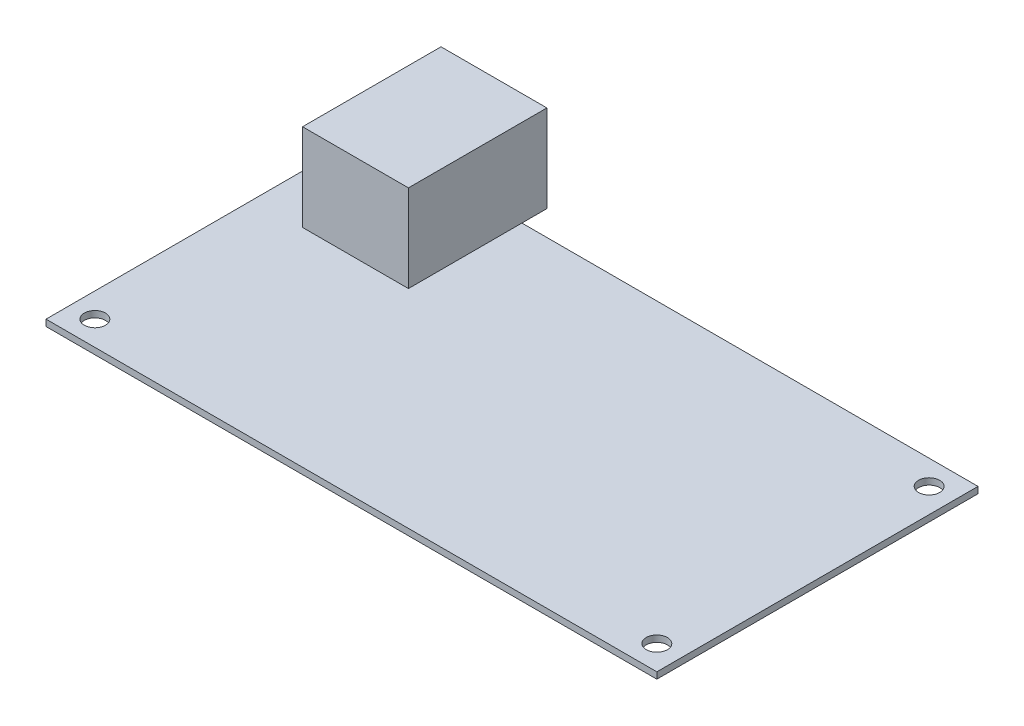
SolidWorks part; units mm, degrees
ref_plane "Front Plane" through (0, 0, 0) normal (0, 0, 1) x (1, 0, 0)
ref_plane "Top Plane" through (0, 0, 0) normal (0, 1, 0) x (1, 0, 0)
ref_plane "Right Plane" through (0, 0, 0) normal (1, 0, 0) x (0, 0, -1)
sketch "Sketch1" plane through (0, 0, 0) normal (0, 1, 0) x (1, 0, 0)
  line L1 (0, 0) -> (95.25, 0)
  line L2 (0, 0) -> (0, 50.08)
  line L3 (0, 50.08) -> (95.25, 50.08)
  line L4 (95.25, 0) -> (95.25, 50.08)
  circle A0 centre (3.81, 3.81) radius 1.65
  circle A1 centre (3.81, 46.27) radius 1.65
  circle A2 centre (91.44, 46.27) radius 1.65
  circle A3 centre (91.44, 3.81) radius 1.65
  dimension "D3" = 3.81
  dimension "D1" = 95.25
  dimension "D2" = 50.08
  dimension "D4" = 3.81
  dimension "D5" = 3.81
  dimension "D6" = 3.81
  dimension "D7" = 3.81
  dimension "D8" = 3.81
  dimension "D9" = 3.81
  dimension "D10" = 3.81
extrude "Extrude1" add sketch "Sketch1" along normal blind 1
sketch "Sketch2" plane through (0, 1, 0) normal (0, 1, 0) x (1, 0, 0)
  line L0 (0, 50.08) -> (0, 0) construction
  line L1 (7.62, 32.385) -> (24.13, 32.385)
  line L2 (7.62, 32.385) -> (7.62, 53.975)
  line L3 (7.62, 53.975) -> (24.13, 53.975)
  line L4 (24.13, 32.385) -> (24.13, 53.975)
  line L5 (7.62, 32.385) -> (24.13, 53.975) construction
  line L6 (7.62, 53.975) -> (24.13, 32.385) construction
  line L7 (0, 0) -> (95.25, 0) construction
  point P0 (15.875, 43.18)
  point P9 (24.0301, 6.5597)
  dimension "D1" = 15.875
  dimension "D2" = 43.18
  dimension "D3" = 16.51
  dimension "D4" = 21.59
extrude "Extrude2" add sketch "Sketch2" along normal blind 13.6
